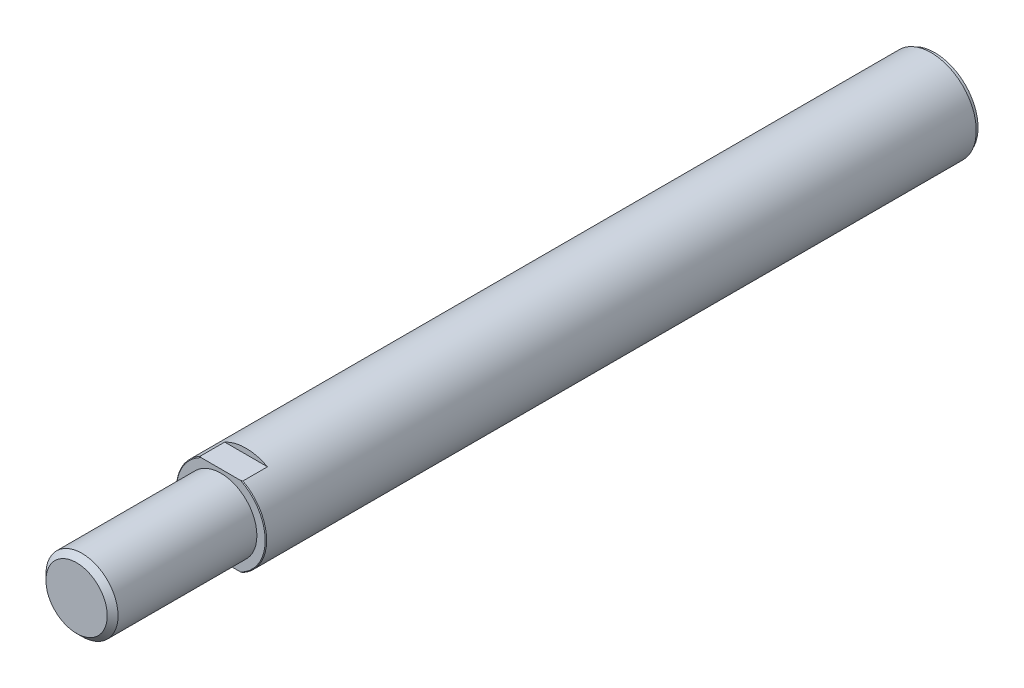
SolidWorks part; units mm, degrees
ref_plane "Plano frontal" through (0, 0, 0) normal (0, 0, 1) x (1, 0, 0)
ref_plane "Plano superior" through (0, 0, 0) normal (0, 1, 0) x (1, 0, 0)
ref_plane "Plano direito" through (0, 0, 0) normal (1, 0, 0) x (0, 0, -1)
sketch "Esboço1" plane through (0, 0, 0) normal (0, 0, 1) x (1, 0, 0)
  circle A0 centre (0, 0) radius 12.5
  dimension "D1" = 25
extrude "Ressalto-extrusão1" add sketch "Esboço1" along normal blind 238
sketch "Esboço2" plane through (0, 0, 238) normal (0, 0, 1) x (1, 0, 0)
  circle A0 centre (0, 0) radius 10
  dimension "D1" = 20
extrude "Corte-extrusão1" cut sketch "Esboço2" against normal blind 40 flip side to cut
chamfer "Chanfro1" distance 0.2 angle 45 1 edges at (12.5, 0, 198)
sketch "Esboço3" plane through (0, 0, 198) normal (0, 0, 1) x (1, 0, 0)
  line L1 (-18.9676, -11) -> (18.9676, -11)
  line L2 (-18.9676, -11) -> (-18.9676, 11)
  line L3 (-18.9676, 11) -> (18.9676, 11)
  line L4 (18.9676, -11) -> (18.9676, 11)
  line L5 (-18.9676, -11) -> (18.9676, 11) construction
  line L6 (-18.9676, 11) -> (18.9676, -11) construction
  point P0 (0, 0)
  dimension "D1" = 22
extrude "Corte-extrusão2" cut sketch "Esboço3" against normal blind 7 flip side to cut
chamfer "Chanfro2" distance 1.5 angle 45 1 edges at (10, 0, 238)
sketch "Esboço4" plane through (0, 0, 0) normal (0, 0, -1) x (-1, 0, 0)
  circle A0 centre (0, 0) radius 12
  dimension "D1" = 24
extrude "Corte-extrusão3" cut sketch "Esboço4" against normal blind 1 flip side to cut
hole_wizard "Furo roscado de M12x1.751" positions "Esboço5" profile "Esboço6" tap size "M12x1.75" standard "Ansi Metric"
sketch "Esboço5" plane through (0, 0, 0) normal (0, 0, -1) x (-1, 0, 0)
  point P0 (0, 0)
sketch "Esboço6" plane through (0, 0, 0) normal (1, 0, 0) x (0, 1, 0)
  line L0 (0, 0) -> (0, 35.8144)
  line L1 (0, 35.8144) -> (5.1, 32.75)
  line L2 (5.1, 32.75) -> (5.1, 0)
  line L5 (5.1, 0) -> (0, 0)
  line L10 (0, 35.8144) -> (-5.1, 32.75) construction
  line L11 (0, -6.35) -> (0, 107.95) construction
  dimension "Tap Drill Dia." = 10.2
  dimension "Tap Drill Depth" = 32.75
  dimension "Drill Angle" = 118
